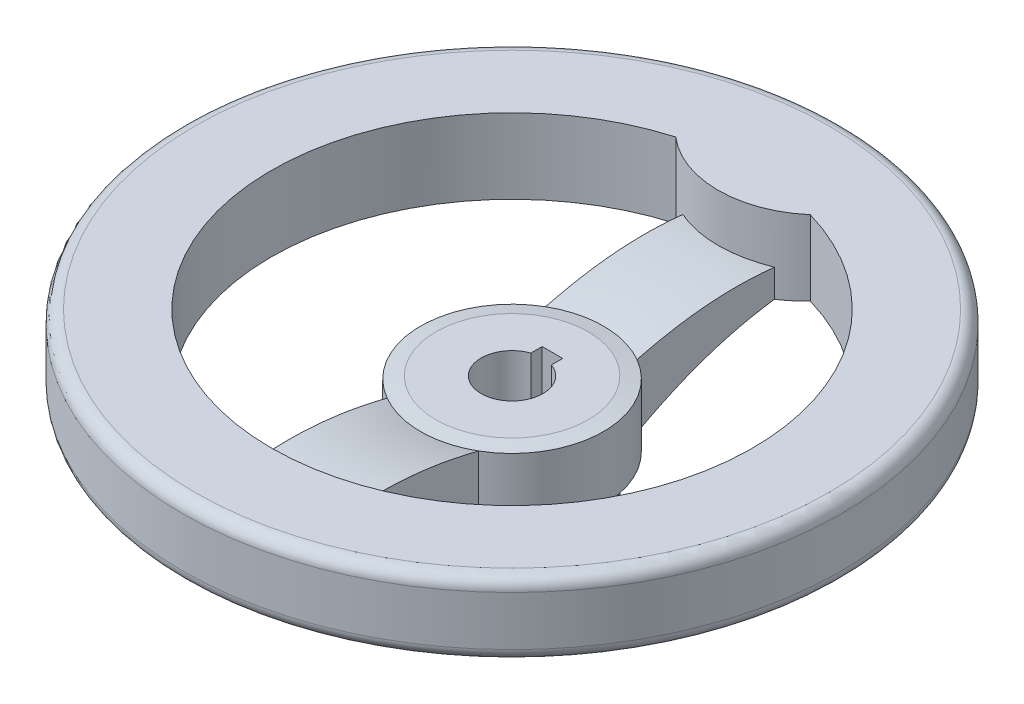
SolidWorks part; units mm, degrees
ref_plane "Front X-Y" through (0, 0, 0) normal (0, 0, 1) x (1, 0, 0)
ref_plane "Top X-Z" through (0, 0, 0) normal (0, 1, 0) x (1, 0, 0)
ref_plane "Right Y-Z" through (0, 0, 0) normal (1, 0, 0) x (0, 0, -1)
ref_plane "Plane1" through (0, 0, 0) normal (0, 0, 1) x (1, 0, 0)
sketch "Sketch1" plane through (0, 0, 0) normal (0, 0, 1) x (1, 0, 0)
  line L0 (0, 32) -> (18.5, 32)
  line L1 (18.5, 32) -> (22.2, 31.36)
  line L2 (58.4, 33.4) -> (58.4, 46)
  line L3 (58.4, 46) -> (77, 46)
  line L4 (80, 43) -> (80, 31)
  line L5 (77, 28) -> (62, 28)
  line L6 (18.5, 13.558) -> (18.5, 0)
  line L7 (18.5, 0) -> (0, 0)
  line L8 (0, 0) -> (0, 32)
  line L9 (0, 0) -> (0, 32) construction
  arc A0 (22.2, 31.36) -> (58.4, 33.4) centre (44.6841, -45.4154) cw
  arc A1 (77, 46) -> (80, 43) centre (77, 43) cw
  arc A2 (80, 31) -> (77, 28) centre (77, 31) cw
  arc A3 (62, 28) -> (18.5, 13.558) centre (64.4007, -51.964) ccw
revolve "Revolve1" add sketch "Sketch1" angle 360 about L9
ref_plane "Plane2" through (0, 0, 0) normal (0, 1, 0) x (1, 0, 0)
sketch "Sketch2" plane through (0, 0, 0) normal (0, 1, 0) x (1, 0, 0)
  line L0 (-11.1, -57.3354) -> (-11.1, -19.2258)
  line L1 (-11.1, 19.2258) -> (-11.1, 57.3354)
  arc A0 (-11.1, 57.3354) -> (-11.1, -57.3354) centre (0, 0) ccw
  arc A1 (-11.1, -19.2258) -> (-11.1, 19.2258) centre (0, 0) cw
extrude "Cut-Extrude1" cut sketch "Sketch2" along normal blind 47
ref_plane "Plane3" through (0, 0, 0) normal (0, 1, 0) x (1, 0, 0)
sketch "Sketch3" plane through (0, 0, 0) normal (0, 1, 0) x (1, 0, 0)
  line L0 (11.1, 57.3354) -> (11.1, 19.2258)
  line L1 (11.1, -19.2258) -> (11.1, -57.3354)
  arc A0 (11.1, -57.3354) -> (11.1, 57.3354) centre (0, 0) ccw
  arc A1 (11.1, 19.2258) -> (11.1, -19.2258) centre (0, 0) cw
extrude "Cut-Extrude2" cut sketch "Sketch3" along normal blind 47
ref_plane "Plane4" through (0, 0, 0) normal (0, 1, 0) x (1, 0, 0)
sketch "Sketch4" plane through (0, 0, 0) normal (0, 1, 0) x (1, 0, 0)
  line L0 (2.5, 7.0711) -> (2.5, 9.8)
  line L1 (2.5, 9.8) -> (-2.5, 9.8)
  line L2 (-2.5, 9.8) -> (-2.5, 7.0711)
  arc A0 (-2.5, 7.0711) -> (2.5, 7.0711) centre (0, 0) ccw
extrude "Cut-Extrude3" cut sketch "Sketch4" along normal blind 32
ref_plane "Plane5" through (0, 0, 0) normal (1, 0, 0) x (0, 0, -1)
sketch "Sketch5" plane through (0, 0, 0) normal (1, 0, 0) x (0, 0, -1)
  line L0 (7, 8) -> (7, 10.067)
  line L1 (7, 10.067) -> (18.067, 10.067)
  line L2 (18.067, 10.067) -> (18.5, 10.5)
  line L3 (18.5, 10.5) -> (18.5, 8)
  line L4 (18.5, 8) -> (7, 8)
  line L5 (18.5, 8) -> (7, 8) construction
revolve "Cut-Revolve1" cut sketch "Sketch5" angle 360 about L5
ref_plane "Plane6" through (0, 46, 0) normal (0, 1, 0) x (1, 0, 0)
sketch "Sketch6" plane through (0, 46, 0) normal (0, 1, 0) x (1, 0, 0)
  arc A0 (-17.8473, 57.4936) -> (17.8473, 57.4936) centre (0, 75) ccw
  arc A1 (17.8473, 57.4936) -> (-17.8473, 57.4936) centre (0, 0) ccw
extrude "Boss-Extrude1" add sketch "Sketch6" against normal blind 21.6
ref_plane "Plane7" through (0, 0, 0) normal (0, 0, 1) x (1, 0, 0)
sketch "Sketch7" plane through (0, 0, 0) normal (0, 0, 1) x (1, 0, 0)
  line L0 (18.5, 0) -> (80, 0)
  line L1 (80, 0) -> (80, 31)
  line L2 (77, 28) -> (62, 28)
  line L3 (22.2, 16) -> (18.5, 9.5914)
  line L4 (18.5, 9.5914) -> (18.5, 0)
  line L5 (0, 0) -> (0, 32) construction
  arc A0 (80, 31) -> (77, 28) centre (77, 31) cw
  arc A1 (62, 28) -> (22.2, 16) centre (64.4007, -51.964) ccw
revolve "Cut-Revolve2" cut sketch "Sketch7" angle 360 about L5
ref_plane "Plane8" through (0, 0, 0) normal (1, 0, 0) x (0, 0, -1)
sketch "Sketch8" plane through (0, 0, 0) normal (1, 0, 0) x (0, 0, -1)
  line L0 (62.5, 116.7) -> (62.6084, 116.7)
  line L1 (72.5, 53.07) -> (72.5, 45.9)
  line L2 (72.5, 45.9) -> (62.5, 45.9)
  line L3 (62.5, 45.9) -> (62.5, 116.7)
  line L4 (62.5, 45.9) -> (62.5, 116.7) construction
  arc A0 (62.6084, 116.7) -> (70.5, 109.63) centre (62.5542, 108.7002) cw
  arc A1 (70.5, 109.63) -> (70.5, 81.35) centre (21.5151, 95.49) cw
  arc A2 (70.5, 81.35) -> (72.5, 53.07) centre (95.5865, 68.9134) ccw
revolve "Revolve2" [suppressed] add sketch "Sketch8" angle 360 about L4
